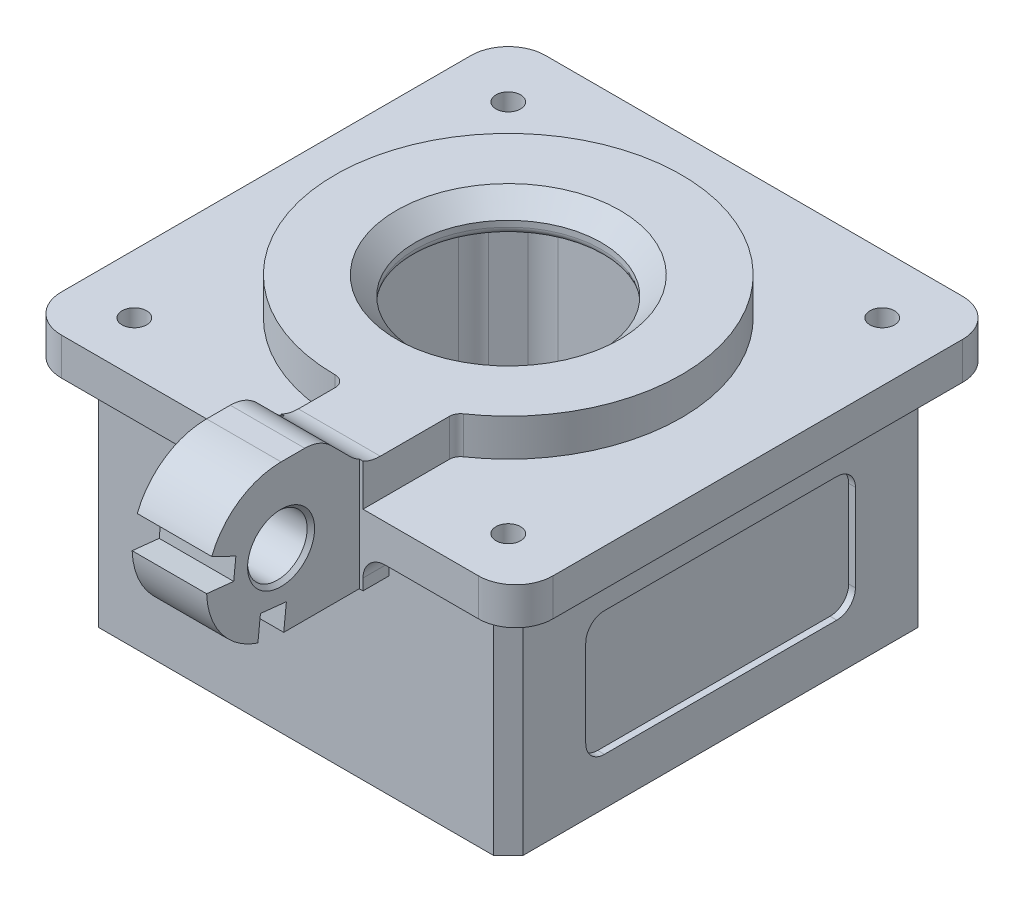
SolidWorks part; units mm, degrees
ref_plane "Front" through (0, 0, 0) normal (0, 0, 1) x (1, 0, 0)
ref_plane "Top" through (0, 0, 0) normal (0, 1, 0) x (1, 0, 0)
ref_plane "Right" through (0, 0, 0) normal (1, 0, 0) x (0, 0, -1)
sketch "Эскиз1" plane through (0, 0, 0) normal (0, 1, 0) x (1, 0, 0)
  line L1 (-33, -33) -> (33, -33)
  line L2 (-33, -33) -> (-33, 33)
  line L3 (-33, 33) -> (33, 33)
  line L4 (33, -33) -> (33, 33)
  line L5 (-33, -33) -> (33, 33) construction
  line L6 (-33, 33) -> (33, -33) construction
  point P1 (0, 0)
  dimension "D1" = 66
  dimension "D2" = 66
extrude "Бобышка-Вытянуть1" add sketch "Эскиз1" along normal blind 40 from offset 14
sketch "Эскиз2" plane through (0, 54, 0) normal (0, 1, 0) x (1, 0, 0)
  circle A0 centre (0, 0) radius 12.5
  dimension "D1" = 25
extrude "Вырез-Вытянуть1" cut sketch "Эскиз2" against normal through all
sketch "Эскиз4" plane through (0, 14, 0) normal (0, -1, 0) x (1, 0, 0)
  line L1 (-23.5, -23.5) -> (23.5, -23.5)
  line L2 (-23.5, -23.5) -> (-23.5, 23.5)
  line L3 (-23.5, 23.5) -> (23.5, 23.5)
  line L4 (23.5, -23.5) -> (23.5, 23.5)
  line L5 (-23.5, -23.5) -> (23.5, 23.5) construction
  line L6 (-23.5, 23.5) -> (23.5, -23.5) construction
  point P0 (0, 0)
  dimension "D1" = 47
  dimension "D2" = 47
extrude "Вырез-Вытянуть3" cut sketch "Эскиз4" against normal blind 32.7
sketch "Эскиз9" plane through (0, 14, 0) normal (0, -1, 0) x (1, 0, 0)
  line L0 (33, -33) -> (-33, -33) construction
  line L1 (-28.5, -28.5) -> (28.5, -28.5)
  line L2 (-28.5, -28.5) -> (-28.5, 28.5)
  line L3 (-28.5, 28.5) -> (28.5, 28.5)
  line L4 (28.5, -28.5) -> (28.5, 28.5)
  line L5 (-28.5, -28.5) -> (28.5, 28.5) construction
  line L6 (-28.5, 28.5) -> (28.5, -28.5) construction
  line L7 (33, 33) -> (33, -33) construction
  line L8 (-33, -33) -> (-33, 33) construction
  line L9 (-33, 33) -> (33, 33) construction
  line L10 (33, -33) -> (-33, -33)
  line L11 (33, 33) -> (33, -33)
  line L12 (-33, -33) -> (-33, 33)
  line L13 (-33, 33) -> (33, 33)
  point P0 (0, 0)
  dimension "D1" = 57
  dimension "D2" = 57
extrude "Вырез-Вытянуть5" cut sketch "Эскиз9" against normal blind 30
hole_wizard "Отверстие обработанное метчиком M41" positions "Эскиз18" profile "Эскиз17" tap size "M4" standard "ISO"
sketch "Эскиз18" plane through (0, 54, 0) normal (0, 1, 0) x (1, 0, 0)
  line L0 (33, 33) -> (-33, -33) construction
  line L2 (-33, 33) -> (33, -33) construction
  point P0 (-25.1023, 25.1023)
  point P2 (25.1023, 25.1023)
  point P5 (-25.1023, -25.1023)
  point P7 (25.1023, -25.1023)
  point P24 (0, 0)
  dimension "D1" = 35.5
  dimension "D2" = 71
  dimension "D3" = 35.5
  dimension "D4" = 71
sketch "Эскиз17" plane through (-25.1023, 54, -25.1023) normal (1, 0, 0) x (0, 0, 1)
  line L0 (0, 0) -> (0, 12.4914)
  line L1 (0, 12.4914) -> (1.65, 11.5)
  line L2 (1.65, 11.5) -> (1.65, 0)
  line L5 (1.65, 0) -> (0, 0)
  line L10 (0, 12.4914) -> (-1.65, 11.5) construction
  line L11 (0, -6.35) -> (0, 107.95) construction
  dimension "Диаметр сверла" = 3.3
  dimension "Глубина сверла" = 11.5
  dimension "Угол заточки сверла" = 118
chamfer "Фаска4" distance 5 angle 45 1 edges at (23.5, 30.35, -23.5)
fillet "Скругление4" radius 4 2 edges at (23.5, 30.35, -18.5) (18.5, 30.35, -23.5)
chamfer "Фаска5" distance 5 angle 45 3 edges at (-23.5, 30.35, 23.5) (23.5, 30.35, 23.5) (-23.5, 30.35, -23.5)
fillet "Скругление5" radius 4 6 edges at (18.5, 30.35, 23.5) (23.5, 30.35, 18.5) (-23.5, 30.35, -18.5) (-18.5, 30.35, -23.5) (-18.5, 30.35, 23.5) (-23.5, 30.35, 18.5)
sketch "Эскиз19" plane through (0, 14, 0) normal (0, -1, 0) x (1, 0, 0)
  line L8 (-27.5, 24.5) -> (-27.5, -24.5)
  line L9 (-24.5, -27.5) -> (24.5, -27.5)
  line L10 (27.5, -24.5) -> (27.5, 24.5)
  line L11 (24.5, 27.5) -> (-24.5, 27.5)
  arc A0 (27.5, -24.5) -> (24.5, -27.5) centre (24.5, -24.5) cw
  arc A1 (-27.5, -24.5) -> (-24.5, -27.5) centre (-24.5, -24.5) ccw
  arc A2 (27.5, 24.5) -> (24.5, 27.5) centre (24.5, 24.5) ccw
  arc A3 (-24.5, 27.5) -> (-27.5, 24.5) centre (-24.5, 24.5) ccw
  dimension "D2" = 3
extrude "Вырез-Вытянуть9" cut sketch "Эскиз19" against normal blind 2
hole_wizard "Отверстие обработанное метчиком M2.51" positions "Эскиз20" profile "Эскиз21" tap size "M2.5" standard "ISO"
sketch "Эскиз20" plane through (0, 16, 0) normal (0, -1, 0) x (-1, 0, 0)
  line L4 (27.5, -24.5) -> (27.5, 24.5) construction
  line L5 (24.5, 27.5) -> (-24.5, 27.5) construction
  point P0 (25, -25)
  point P2 (25, 25)
  point P4 (-25, 25)
  point P6 (-25, -25)
  dimension "D1" = 50
  dimension "D2" = 50
  dimension "D3" = 25
  dimension "D4" = 25
  dimension "D5" = 25
sketch "Эскиз21" plane through (-25, 16, 25) normal (1, 0, 0) x (0, 0, -1)
  line L0 (0, 0) -> (0, 7.8659)
  line L1 (0, 7.8659) -> (1.025, 7.25)
  line L2 (1.025, 7.25) -> (1.025, 0)
  line L5 (1.025, 0) -> (0, 0)
  line L10 (0, 7.8659) -> (-1.025, 7.25) construction
  line L11 (0, -6.35) -> (0, 107.95) construction
  dimension "Диаметр сверла" = 2.05
  dimension "Глубина сверла" = 7.25
  dimension "Угол заточки сверла" = 118
chamfer "Фаска6" distance 2 angle 45 4 edges at (28.5, 29, -28.5) (28.5, 29, 28.5) (-28.5, 29, -28.5) (-28.5, 29, 28.5)
chamfer "Фаска7" distance 2.5 angle 45 1 edges at (0, 54, 12.5)
sketch "Эскиз29" plane through (0, 54, 0) normal (0, 1, 0) x (1, 0, 0)
  line L0 (33, -33) -> (33, 33) construction
  line L1 (-33, -33) -> (33, -33) construction
  line L2 (-33, 33) -> (-33, -33) construction
  line L3 (33, 33) -> (-33, 33) construction
  line L4 (33, -33) -> (33, 33)
  line L5 (-33, -33) -> (33, -33)
  line L6 (-33, 33) -> (-33, -33)
  line L7 (33, 33) -> (-33, 33)
  circle A0 centre (0, 0) radius 23.25
  dimension "D1" = 46.5
extrude "Вырез-Вытянуть15" cut sketch "Эскиз29" against normal blind 5
sketch "Эскиз30" plane through (0, 49, 0) normal (0, 1, 0) x (1, 0, 0)
  line L0 (33, -33) -> (33, 33) construction
  line L1 (-33, -33) -> (33, -33)
  line L2 (-33, -33) -> (-33, -32)
  line L3 (-33, -32) -> (33, -32)
  line L4 (33, -33) -> (33, -32)
  dimension "D1" = 1
extrude "Вырез-Вытянуть16" cut sketch "Эскиз30" against normal through all
fillet "Скругление8" radius 5 4 edges at (-33, 46.5, -33) (33, 46.5, -33) (33, 46.5, 32) (-33, 46.5, 32)
sketch "Эскиз31" plane through (0, 16, 0) normal (0, -1, 0) x (1, 0, 0)
  line L0 (24.5, -16.8431) -> (24.5, 16.8431)
  line L1 (23.0355, 20.3787) -> (20.3787, 23.0355)
  line L2 (16.8431, 24.5) -> (-16.8431, 24.5)
  line L3 (-20.3787, 23.0355) -> (-23.0355, 20.3787)
  line L4 (-24.5, 16.8431) -> (-24.5, -16.8431)
  line L5 (-23.0355, -20.3787) -> (-20.3787, -23.0355)
  line L6 (-16.8431, -24.5) -> (16.8431, -24.5)
  line L7 (20.3787, -23.0355) -> (23.0355, -20.3787)
  line L8 (19.6716, -22.3284) -> (22.3284, -19.6716)
  line L9 (-16.8431, -23.5) -> (16.8431, -23.5)
  line L10 (-22.3284, -19.6716) -> (-19.6716, -22.3284)
  line L11 (-23.5, 16.8431) -> (-23.5, -16.8431)
  line L12 (-19.6716, 22.3284) -> (-22.3284, 19.6716)
  line L13 (16.8431, 23.5) -> (-16.8431, 23.5)
  line L14 (22.3284, 19.6716) -> (19.6716, 22.3284)
  line L15 (23.5, -16.8431) -> (23.5, 16.8431)
  line L16 (19.6716, -22.3284) -> (22.3284, -19.6716) construction
  line L17 (-16.8431, -23.5) -> (16.8431, -23.5) construction
  line L18 (-22.3284, -19.6716) -> (-19.6716, -22.3284) construction
  line L19 (-23.5, 16.8431) -> (-23.5, -16.8431) construction
  line L20 (-19.6716, 22.3284) -> (-22.3284, 19.6716) construction
  line L21 (16.8431, 23.5) -> (-16.8431, 23.5) construction
  line L22 (22.3284, 19.6716) -> (19.6716, 22.3284) construction
  line L24 (26.5, -16.8431) -> (26.5, 16.8431)
  line L25 (24.4497, 21.7929) -> (21.7929, 24.4497)
  line L26 (16.8431, 26.5) -> (-16.8431, 26.5)
  line L27 (-21.7929, 24.4497) -> (-24.4497, 21.7929)
  line L28 (-26.5, 16.8431) -> (-26.5, -16.8431)
  line L29 (-24.4497, -21.7929) -> (-21.7929, -24.4497)
  line L30 (-16.8431, -26.5) -> (16.8431, -26.5)
  line L31 (21.7929, -24.4497) -> (24.4497, -21.7929)
  line L32 (23.5, -16.8431) -> (23.5, 16.8431) construction
  arc A0 (24.5, 16.8431) -> (23.0355, 20.3787) centre (19.5, 16.8431) ccw
  arc A1 (20.3787, 23.0355) -> (16.8431, 24.5) centre (16.8431, 19.5) ccw
  arc A2 (-16.8431, 24.5) -> (-20.3787, 23.0355) centre (-16.8431, 19.5) ccw
  arc A3 (-23.0355, 20.3787) -> (-24.5, 16.8431) centre (-19.5, 16.8431) ccw
  arc A4 (-24.5, -16.8431) -> (-23.0355, -20.3787) centre (-19.5, -16.8431) ccw
  arc A5 (-20.3787, -23.0355) -> (-16.8431, -24.5) centre (-16.8431, -19.5) ccw
  arc A6 (16.8431, -24.5) -> (20.3787, -23.0355) centre (16.8431, -19.5) ccw
  arc A7 (23.0355, -20.3787) -> (24.5, -16.8431) centre (19.5, -16.8431) ccw
  arc A8 (16.8431, -23.5) -> (19.6716, -22.3284) centre (16.8431, -19.5) ccw
  arc A9 (-19.6716, -22.3284) -> (-16.8431, -23.5) centre (-16.8431, -19.5) ccw
  arc A10 (-23.5, -16.8431) -> (-22.3284, -19.6716) centre (-19.5, -16.8431) ccw
  arc A11 (-22.3284, 19.6716) -> (-23.5, 16.8431) centre (-19.5, 16.8431) ccw
  arc A12 (-16.8431, 23.5) -> (-19.6716, 22.3284) centre (-16.8431, 19.5) ccw
  arc A13 (19.6716, 22.3284) -> (16.8431, 23.5) centre (16.8431, 19.5) ccw
  arc A14 (23.5, 16.8431) -> (22.3284, 19.6716) centre (19.5, 16.8431) ccw
  arc A15 (22.3284, -19.6716) -> (23.5, -16.8431) centre (19.5, -16.8431) ccw
  arc A16 (16.8431, -23.5) -> (19.6716, -22.3284) centre (16.8431, -19.5) ccw construction
  arc A17 (-19.6716, -22.3284) -> (-16.8431, -23.5) centre (-16.8431, -19.5) ccw construction
  arc A18 (-23.5, -16.8431) -> (-22.3284, -19.6716) centre (-19.5, -16.8431) ccw construction
  arc A19 (-22.3284, 19.6716) -> (-23.5, 16.8431) centre (-19.5, 16.8431) ccw construction
  arc A20 (-16.8431, 23.5) -> (-19.6716, 22.3284) centre (-16.8431, 19.5) ccw construction
  arc A21 (19.6716, 22.3284) -> (16.8431, 23.5) centre (16.8431, 19.5) ccw construction
  arc A22 (23.5, 16.8431) -> (22.3284, 19.6716) centre (19.5, 16.8431) ccw construction
  arc A23 (22.3284, -19.6716) -> (23.5, -16.8431) centre (19.5, -16.8431) ccw construction
  arc A24 (26.5, 16.8431) -> (24.4497, 21.7929) centre (19.5, 16.8431) ccw
  arc A25 (21.7929, 24.4497) -> (16.8431, 26.5) centre (16.8431, 19.5) ccw
  arc A26 (-16.8431, 26.5) -> (-21.7929, 24.4497) centre (-16.8431, 19.5) ccw
  arc A27 (-24.4497, 21.7929) -> (-26.5, 16.8431) centre (-19.5, 16.8431) ccw
  arc A28 (-26.5, -16.8431) -> (-24.4497, -21.7929) centre (-19.5, -16.8431) ccw
  arc A29 (-21.7929, -24.4497) -> (-16.8431, -26.5) centre (-16.8431, -19.5) ccw
  arc A30 (16.8431, -26.5) -> (21.7929, -24.4497) centre (16.8431, -19.5) ccw
  arc A31 (24.4497, -21.7929) -> (26.5, -16.8431) centre (19.5, -16.8431) ccw
  dimension "D1" = 0
  dimension "D2" = 1
  dimension "D3" = 2
extrude "Вырез-Вытянуть17" cut sketch "Эскиз31" against normal blind 1.5
ref_plane "Плоскость1" through (7, 0, 0) normal (1, 0, 0) x (0, 0, -1)
sketch "Эскиз34" plane through (7, 0, 0) normal (1, 0, 0) x (0, 0, -1)
  line L0 (-23.25, 54) -> (-31.75, 54)
  line L1 (-28.5, 39.5) -> (-42.5, 39.5)
  line L2 (-28.5, 14) -> (-28.5, 44) construction
  line L3 (-42.5, 59.5) -> (-37.25, 59.5)
  line L4 (-37.25, 59.5) -> (-31.75, 54)
  line L5 (-32, 44) -> (-27, 44) construction
  line L6 (-32, 44) -> (-32, 49) construction
  line L7 (-23.25, 54) -> (-23.25, 49)
  line L8 (-23.25, 49) -> (-32, 49)
  line L9 (-32, 49) -> (-32, 44)
  line L10 (-32, 44) -> (-28.5, 44)
  line L11 (-28.5, 44) -> (-28.5, 39.5)
  arc A0 (-42.5, 39.5) -> (-42.5, 59.5) centre (-42.5, 49.5) cw
  circle A1 centre (-42.5, 49.5) radius 4
  dimension "D2" = 10
  dimension "D3" = 8
  dimension "D6" = 10.5
  dimension "D1" = 4.5
  dimension "D4" = 8.5
  dimension "D5" = 135
extrude "Бобышка-Вытянуть2" add sketch "Эскиз34" along normal blind 5.5 and the other way blind 5.5
sketch "Эскиз35" plane through (0, 0, 23.25) normal (0, 0, -1) x (-1, 0, 0)
  line L0 (-12.5, 54) -> (-1.5, 54)
  line L1 (-1.5, 54) -> (-1.5, 49)
  line L2 (-1.5, 49) -> (-12.5, 49) construction
  line L3 (-1.5, 49) -> (-12.5, 49)
  line L4 (-12.5, 49) -> (-12.5, 54)
extrude "Бобышка-Вытянуть3" add sketch "Эскиз35" along normal up to surface (3.6461 mm away)
fillet "Скругление9" radius 1.5 2 edges at (1.5, 51.5, 23.2016) (12.5, 51.5, 19.6039)
fillet "Скругление10" radius 3 2 edges at (1.5, 44, 30.25) (12.5, 44, 30.25)
fillet "Скругление11" radius 5 2 edges at (7, 54, 31.75) (7, 59.5, 37.25)
chamfer "Фаска8" distance 0.5 angle 45 2 edges at (1.5, 49.5, 38.5) (12.5, 49.5, 38.5)
sketch "Эскиз36" plane through (12.5, 0, 0) normal (1, 0, 0) x (0, 0, -1)
  line L0 (-42.25, 49.5) -> (-55.7681, 50.9208) construction
  line L1 (-51.8243, 53.1599) -> (-48.5681, 51.5718)
  line L2 (-48.5681, 51.5718) -> (-48.8607, 48.7871)
  line L3 (-48.8607, 48.7871) -> (-52.4947, 49.169)
  line L4 (-42.5, 39.5) -> (-28.5, 39.5) construction
  arc A0 (-42.5, 59.5) -> (-42.5, 39.5) centre (-42.5, 49.5) ccw construction
  arc A1 (-51.8243, 53.1599) -> (-52.4947, 49.169) centre (-42.25, 49.5) ccw
  point P10 (-48.7144, 50.1794)
  dimension "D1" = 6.5
  dimension "D2" = 20
  dimension "D3" = 1.4
  dimension "D4" = 6
  dimension "D6" = 2.9289
extrude "Вырез-Вытянуть18" cut sketch "Эскиз36" against normal through all and the other way blind 10
sketch "Эскиз39" plane through (0, 46.7, 0) normal (0, -1, 0) x (1, 0, 0)
  circle A0 centre (0, 0) radius 17.5
  dimension "D1" = 35
extrude "Вырез-Вытянуть20" cut sketch "Эскиз39" against normal blind 3
sketch "Эскиз40" plane through (0, 49.7, 0) normal (0, -1, 0) x (1, 0, 0)
  circle A0 centre (0, 0) radius 16
  circle A1 centre (0, 0) radius 17.5
  dimension "D1" = 32
  dimension "D2" = 35
extrude "Вырез-Вытянуть21" cut sketch "Эскиз40" against normal blind 0.5
fillet "Скругление12" radius 1 1 edges at (0, 49.7, -12.5)
hole_wizard "Отверстие обработанное метчиком M32" positions "Эскиз44" profile "Эскиз45" tap size "M3" standard "ISO"
sketch "Эскиз44" plane through (0, 46.7, 0) normal (0, -1, 0) x (-1, 0, 0)
  point P0 (20, 0)
  point P3 (0, -20)
  point P6 (-20, 0)
  point P9 (0, 20)
sketch "Эскиз45" plane through (-20, 46.7, 0) normal (1, 0, 0) x (0, 0, -1)
  line L0 (0, 0) -> (0, 6.7511)
  line L1 (0, 6.7511) -> (1.25, 6)
  line L2 (1.25, 6) -> (1.25, 0)
  line L5 (1.25, 0) -> (0, 0)
  line L10 (0, 6.7511) -> (-1.25, 6) construction
  line L11 (0, -6.35) -> (0, 107.95) construction
  dimension "Диаметр сверла" = 2.5
  dimension "Глубина сверла" = 6
  dimension "Угол заточки сверла" = 118
sketch "Эскиз46" plane through (12.5, 0, 0) normal (1, 0, 0) x (0, 0, -1)
  line L0 (-42.5, 49.5) -> (-43.7493, 37.614) construction
  line L1 (-28.5, 14) -> (-28.5, 44) construction
  line L2 (-42.1433, 39.5) -> (-41.7871, 42.8893)
  line L3 (-41.7871, 42.8893) -> (-45.2679, 43.2551)
  line L4 (-45.2679, 43.2551) -> (-45.6105, 39.9961)
  line L5 (-42.5, 39.5) -> (-28.5, 39.5) construction
  line L6 (-42.5, 39.5) -> (-42.1433, 39.5)
  arc A0 (-52.4945, 49.169) -> (-42.5, 39.5) centre (-42.5, 49.5) ccw construction
  arc A1 (-45.6105, 39.9961) -> (-42.5, 39.5) centre (-42.5, 49.5) ccw
  dimension "D1" = 6
  dimension "D2" = 1.4
  dimension "D3" = 3.5
  dimension "D5" = 6.5
extrude "Вырез-Вытянуть22" cut sketch "Эскиз46" against normal through all
sketch "Эскиз47" plane through (0, 59.5, 0) normal (0, 1, 0) x (1, 0, 0)
  line L0 (1.5, -32) -> (-28, -32) construction
  line L1 (-3.2034, -32) -> (2, -32)
  line L2 (-3.2034, -32) -> (-3.2034, -55.6684)
  line L3 (-3.2034, -55.6684) -> (2, -55.6684)
  line L4 (2, -32) -> (2, -55.6684)
  line L5 (28, -32) -> (12.5, -32) construction
  line L6 (17.759, -32) -> (12, -32)
  line L7 (17.759, -32) -> (17.759, -55.6684)
  line L8 (17.759, -55.6684) -> (12, -55.6684)
  line L9 (12, -32) -> (12, -55.6684)
  line L10 (1.5, -42.5) -> (1.5, -51.8091) construction
  dimension "D1" = 0.5
  dimension "D2" = 0.5
extrude "Вырез-Вытянуть23" cut sketch "Эскиз47" against normal through all
chamfer "Фаска9" distance 0.5 angle 45 2 edges at (2, 49.5, 38.5) (12, 49.5, 46.5)
sketch "Эскиз48" plane through (28.5, 0, 0) normal (1, 0, 0) x (0, 0, -1)
  line L0 (0, 54) -> (0, 14) construction
  line L1 (15, 54) -> (-15, 54) construction
  line L2 (26.5, 14) -> (-26.5, 14) construction
  line L3 (26.5, 44) -> (-26.5, 44) construction
  line L4 (-15.6, 20.3) -> (15.6, 20.3)
  line L5 (-18.1, 22.8) -> (-18.1, 34.5)
  line L6 (-15.6, 37) -> (15.6, 37)
  line L7 (18.1, 22.8) -> (18.1, 34.5)
  line L8 (-18.1, 20.3) -> (18.1, 37) construction
  line L9 (-18.1, 37) -> (18.1, 20.3) construction
  arc A0 (-18.1, 22.8) -> (-15.6, 20.3) centre (-15.6, 22.8) ccw
  arc A1 (15.6, 20.3) -> (18.1, 22.8) centre (15.6, 22.8) ccw
  arc A2 (18.1, 34.5) -> (15.6, 37) centre (15.6, 34.5) ccw
  arc A3 (-15.6, 37) -> (-18.1, 34.5) centre (-15.6, 34.5) ccw
  point P6 (0, 28.65)
  dimension "D4" = 2.5
  dimension "D1" = 36.2
  dimension "D2" = 16.7
  dimension "D3" = 7
extrude "Вырез-Вытянуть24" cut sketch "Эскиз48" against normal blind 0.9
